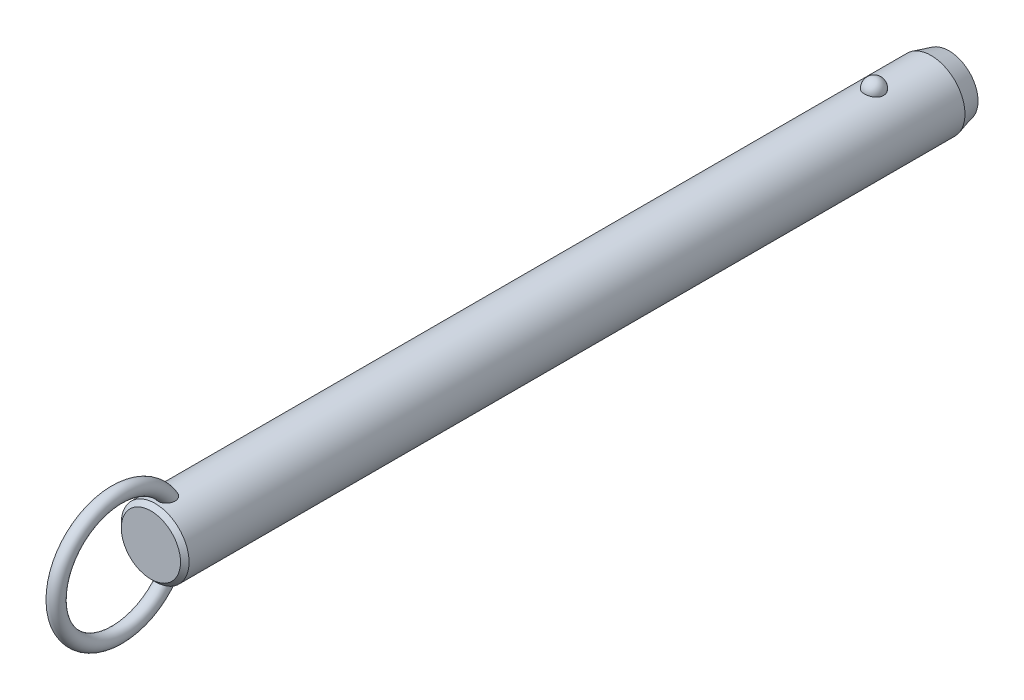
SolidWorks part; units mm, degrees
ref_plane "Front Plane" through (0, 0, 0) normal (0, 0, 1) x (1, 0, 0)
ref_plane "Top Plane" through (0, 0, 0) normal (0, 1, 0) x (1, 0, 0)
ref_plane "Right Plane" through (0, 0, 0) normal (1, 0, 0) x (0, 0, -1)
sketch "Sketch2" plane through (0, 0, 0) normal (0, 0, 1) x (1, 0, 0)
  circle A0 centre (0, 0) radius 9.5
  point P3 (0, 9.5)
  dimension "D1" = 19
extrude "Boss-Extrude1" add sketch "Sketch2" along normal blind 190.5
sketch "Sketch3" plane through (0, 0, 0) normal (0, 0, -1) x (-1, 0, 0)
  circle A0 centre (0, 0) radius 9.5
  dimension "D1" = 19
extrude "Boss-Extrude2" add sketch "Sketch3" along normal blind 23.7
chamfer "Chamfer1" distance 5 angle 15 1 edges at (-9.5, 0, -23.7)
sketch "Sketch12" plane through (0, 0, 0) normal (1, 0, 0) x (0, 0, -1)
  line L0 (-190.5, 9.5) -> (-190.5, -9.5) construction
  point P0 (-190.5, 0)
sketch "Sketch13" plane through (0, 0, 0) normal (1, 0, 0) x (0, 0, -1)
  circle A0 centre (-209.55, 0) radius 19.05
  point P2 (-190.5, 0)
  dimension "D1" = 38.1
sketch "Sketch14" plane through (0, 0, 0) normal (0, 1, 0) x (1, 0, 0)
  circle A0 centre (0, -192.5) radius 2
  point P2 (0, -190.5)
  dimension "D1" = 4
sweep "Sweep1" add profiles "Sketch14" path "Sketch13"
sketch "Sketch15" plane through (0, 0, 190.5) normal (0, 0, 1) x (1, 0, 0)
  circle A0 centre (0, 0) radius 9.5
  dimension "D1" = 19
extrude "Boss-Extrude3" add sketch "Sketch15" along normal blind 9.52
chamfer "Chamfer2" distance 1.2 angle 45 1 edges at (9.5, 0, 200.02)
sketch "Sketch18" plane through (0, 0, 0) normal (1, 0, 0) x (0, 0, -1)
  line L0 (18.7, 9.5) -> (-193.0378, 9.5) construction
  line L1 (2.7, 12.2) -> (2.7, 6.8)
  line L2 (-193.0378, -9.5) -> (18.7, -9.5) construction
  arc A0 (2.7, 12.2) -> (2.7, 6.8) centre (2.7, 9.5) ccw
  point P4 (0, 9.5)
  dimension "D1" = 21.7
revolve "Revolve1" add sketch "Sketch18" angle 360 about L1
